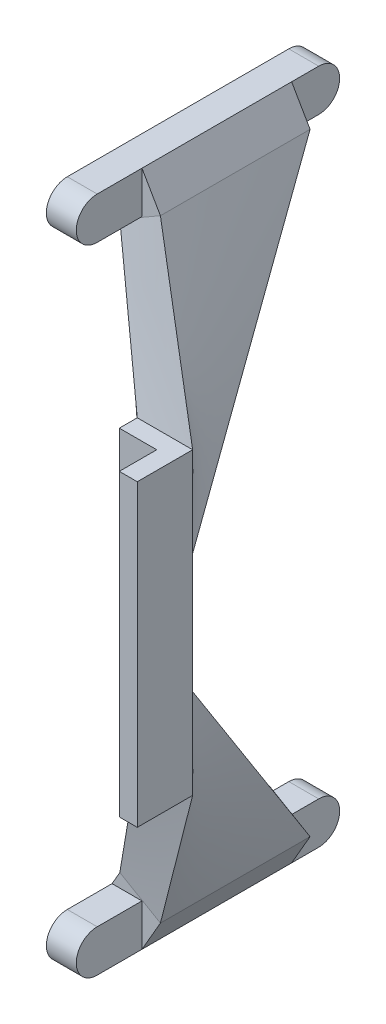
SolidWorks part; units mm, degrees
ref_plane "Front Plane" through (0, 0, 0) normal (0, 0, 1) x (1, 0, 0)
ref_plane "Top Plane" through (0, 0, 0) normal (0, 1, 0) x (1, 0, 0)
ref_plane "Right Plane" through (0, 0, 0) normal (1, 0, 0) x (0, 0, -1)
ref_plane "Plane2" through (-19.6405, 0, 0) normal (1, 0, 0) x (0, 0, -1)
sketch "Sketch13" plane through (-19.6405, 0, 0) normal (1, 0, 0) x (0, 0, -1)
  line L0 (0.6667, 64.1125) -> (47.6567, 64.1125) construction
  line L1 (0.6667, 68.5575) -> (47.6567, 68.5575)
  line L2 (0.6667, 59.6675) -> (47.6567, 59.6675)
  arc A0 (0.6667, 68.5575) -> (0.6667, 59.6675) centre (0.6667, 64.1125) ccw
  arc A1 (47.6567, 59.6675) -> (47.6567, 68.5575) centre (47.6567, 64.1125) ccw
  circle A2 centre (47.6567, 64.1125) radius 1.27 construction
  circle A3 centre (0.6667, 64.1125) radius 1.27 construction
  point P2 (24.1617, 64.1125)
  point P9 (0, 0)
  dimension "D1" = 4.445
extrude "Boss-Extrude8" add sketch "Sketch13" along normal blind 6.35 separate body
ref_plane "Plane5" through (0, 28.5525, 0) normal (0, -1, 0) x (-1, 0, 0)
sketch "Sketch5" plane through (0, 28.5525, 0) normal (0, 1, 0) x (1, 0, 0)
  line L0 (0, 0) -> (-7.9375, 0)
  line L1 (0, 0) -> (0, -7.9375)
  line L2 (0, -7.9375) -> (3.81, -7.9375)
  line L3 (3.81, -7.9375) -> (3.81, 3.81)
  line L4 (3.81, 3.81) -> (-7.9375, 3.81)
  line L5 (-7.9375, 3.81) -> (-7.9375, 0)
  dimension "D1" = 3.81
  dimension "D2" = 3.81
  dimension "D3" = 7.9375
  dimension "D4" = 7.9375
extrude "Boss-Extrude3" add sketch "Sketch5" against normal blind 63.5
pattern_linear "LPattern2" count 2 spacing 134.62 along (0, -1, 0) of "Boss-Extrude8"
ref_plane "Plane4" through (0, 0, -41.91) normal (0, 0, -1) x (-1, 0, 0)
sketch "Sketch16" plane through (0, 0, -41.91) normal (0, 0, -1) x (-1, 0, 0)
  line L0 (13.2905, 68.5575) -> (9.3776, 61.7801)
  line L1 (9.3776, 61.7801) -> (17.9895, 56.8079)
  line L2 (17.9895, 56.8079) -> (19.6405, 59.6675)
  line L3 (19.6405, 30.2451) -> (19.6405, -30.245) construction
  line L4 (19.6405, 59.6675) -> (13.2905, 59.6675)
  line L5 (13.2905, 59.6675) -> (13.2905, 68.5575)
  line L6 (13.2905, 59.6675) -> (19.6405, 59.6675) construction
  point P3 (13.2905, 59.6774)
  point P10 (19.6405, 57.3416)
  point P13 (17.2478, 54.3669)
  point P14 (0, 0)
  dimension "D1" = 30
  dimension "D2" = 0.127
extrude "Boss-Extrude9" add sketch "Sketch16" against normal blind 31.75
sketch "Sketch17" plane through (0, 0, -3.81) normal (0, 0, 1) x (1, 0, 0)
  line L1 (-7.9375, -34.9475) -> (-7.9375, 28.5525) construction
  line L2 (-7.9375, 28.5525) -> (3.81, 28.5525)
  line L3 (-7.9375, 28.5525) -> (-7.9375, 9.5025)
  line L4 (-7.9375, 9.5025) -> (3.81, 9.5025)
  line L7 (3.81, 28.5525) -> (3.81, 9.5025)
  line L8 (3.81, -34.9475) -> (3.81, 28.5525) construction
  point P8 (0, 0)
  dimension "D1" = 19.05
sketch "Sketch18" plane through (-29.0959, 50.3956, 0) normal (0.5, -0.866, 0) x (0.866, 0.5, 0)
  line L1 (22.7688, -41.91) -> (12.8246, -41.91)
  line L2 (22.7688, -41.91) -> (22.7688, -10.16)
  line L3 (22.7688, -10.16) -> (12.8246, -10.16)
  line L4 (12.8246, -41.91) -> (12.8246, -10.16)
loft "Loft1" add profiles "Sketch18", "Sketch17"
ref_plane "Plane6" through (0, 64.1125, 0) normal (0, -1, 0) x (-1, 0, 0)
ref_plane "Plane7" through (0, -3.1975, 0) normal (0, -1, 0) x (-1, 0, 0)
mirror "Mirror3" about plane through (0, -3.1975, 0) normal (0, -1, 0) of "Loft1"
mirror "Mirror4" about plane through (0, -3.1975, 0) normal (0, -1, 0) of "Boss-Extrude9"
